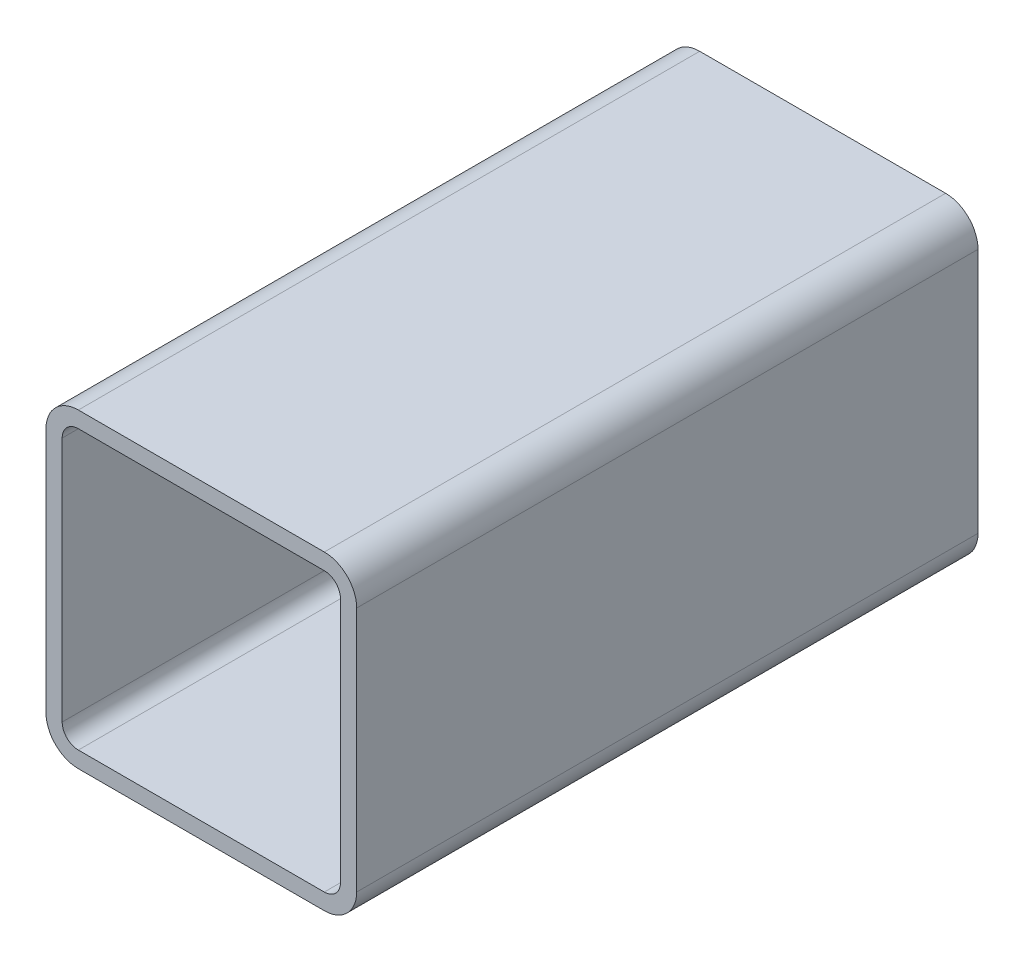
SolidWorks part; units mm, degrees
ref_plane "Front Plane" through (0, 0, 0) normal (0, 0, 1) x (1, 0, 0)
ref_plane "Top Plane" through (0, 0, 0) normal (0, 1, 0) x (1, 0, 0)
ref_plane "Right Plane" through (0, 0, 0) normal (1, 0, 0) x (0, 0, -1)
sketch "Sketch1" plane through (0, 0, 0) normal (0, 0, 1) x (1, 0, 0)
sketch_block_instance "HSS6x6x0.3125-1"
sketch_block "HSS6x6x0.3125"
extrude "Boss-Extrude1" add sketch "Sketch1" along normal blind 304.8
